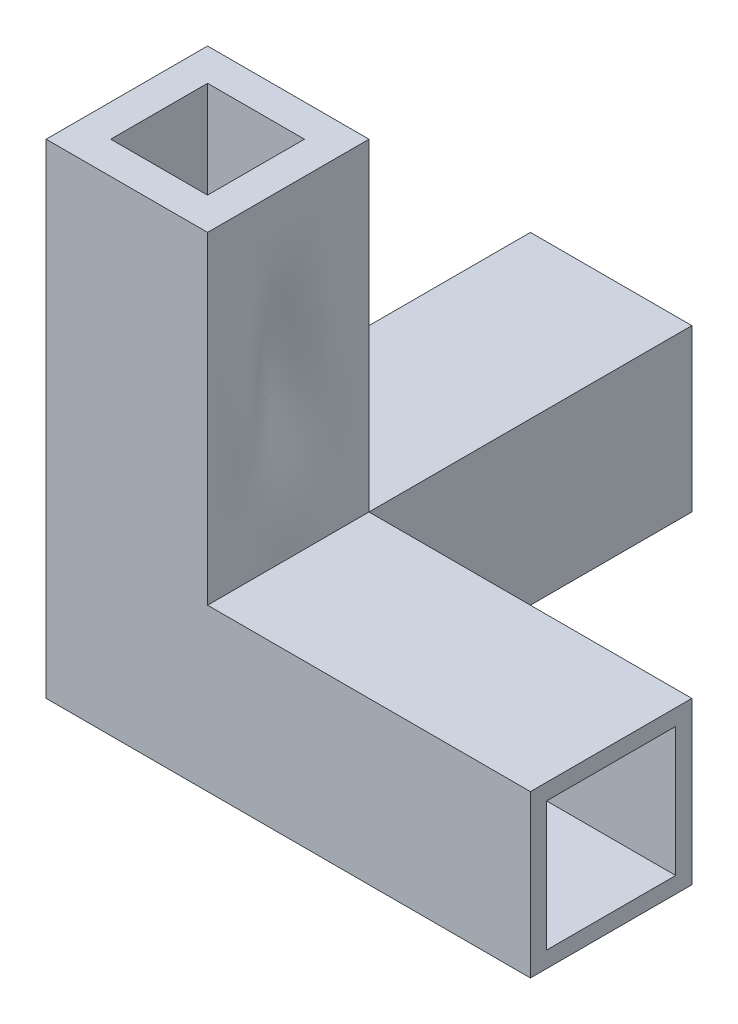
SolidWorks part; units mm, degrees
ref_plane "Front Plane" through (0, 0, 0) normal (0, 0, 1) x (1, 0, 0)
ref_plane "Top Plane" through (0, 0, 0) normal (0, 1, 0) x (1, 0, 0)
ref_plane "Right Plane" through (0, 0, 0) normal (1, 0, 0) x (0, 0, -1)
sketch "Sketch2" plane through (0, 0, 0) normal (0, 1, 0) x (1, 0, 0)
  line L0 (0, 0) -> (60, 0)
  line L1 (60, 0) -> (60, 20)
  line L2 (60, 20) -> (20, 20)
  line L3 (20, 20) -> (20, 60)
  line L4 (20, 60) -> (0, 60)
  line L5 (0, 60) -> (0, 0)
  dimension "D1" = 60
  dimension "D2" = 20
extrude "Boss-Extrude1" add sketch "Sketch2" along normal mid plane 20
sketch "Sketch3" plane through (0, 10, 0) normal (0, 1, 0) x (1, 0, 0)
  line L0 (60, 20) -> (20, 20) construction
  line L1 (0, 0) -> (20, 0)
  line L2 (0, 0) -> (0, 20)
  line L3 (0, 20) -> (20, 20)
  line L4 (20, 0) -> (20, 20)
extrude "Boss-Extrude2" add sketch "Sketch3" along normal blind 40 separate body
shell "Shell1" thickness 2
combine bodies "Combine2" operation type add bodies to combine 102 101
sketch "Sketch4" plane through (0, 50, 0) normal (0, 1, 0) x (1, 0, 0)
  line L8 (4, 16) -> (4, 4)
  line L9 (4, 4) -> (16, 4)
  line L10 (16, 4) -> (16, 16)
  line L11 (16, 16) -> (4, 16)
  line L12 (4, 16) -> (4, 4)
  line L13 (4, 4) -> (16, 4)
  line L14 (16, 4) -> (16, 16)
  line L15 (16, 16) -> (4, 16)
  dimension "D1" = 4
extrude "Cut-Extrude1" cut sketch "Sketch4" against normal up to surface (42 mm away)
other "Freeform4"
other "Freeform5"
